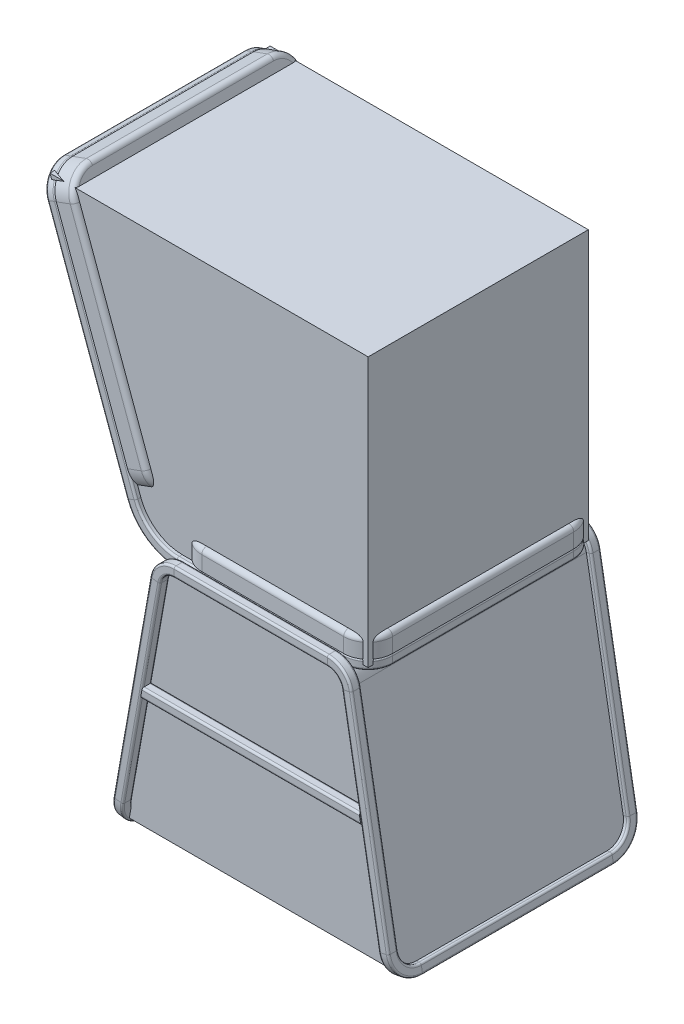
SolidWorks part; units mm, degrees
ref_plane "Front Plane" through (0, 0, 0) normal (0, 0, 1) x (1, 0, 0)
ref_plane "Top Plane" through (0, 0, 0) normal (0, 1, 0) x (1, 0, 0)
ref_plane "Right Plane" through (0, 0, 0) normal (1, 0, 0) x (0, 0, -1)
sketch "Sketch1" plane through (0, 0, 0) normal (0, 0, 1) x (1, 0, 0)
  line L0 (0, 0) -> (-450, 0)
  line L1 (-450, 0) -> (-650.1836, 550)
  line L2 (-650.1836, 550) -> (0, 550)
  line L3 (0, 550) -> (0, 0)
  dimension "D1" = 450
  dimension "D2" = 550
  dimension "D3" = 110
extrude "Boss-Extrude1" add sketch "Sketch1" along normal mid plane 450
sketch3d "3DSketch1"
  line L0 (-636.5028, 512.4123, -225) -> (-636.5028, 512.4123, 225)
  line L1 (-473.9485, 65.798, -225) -> (-473.9485, 65.798, 225)
  line L2 (-379.9792, 0, -225) -> (-379.9792, 0, 225)
  line L4 (-650.1836, 550, -225) -> (-450, 0, -225)
  line L5 (-450, 0, -225) -> (-450, 0, 225)
  line L6 (-450, 0, 225) -> (-650.1836, 550, 225)
  line L7 (-650.1836, 550, 225) -> (-650.1836, 550, -225)
  line L8 (-636.5028, 512.4123, -225) -> (-473.9485, 65.798, -225)
  line L10 (-473.9485, 65.798, 225) -> (-636.5028, 512.4123, 225)
  line L11 (-650.1836, 550, 185) -> (-650.1836, 550, -185)
  line L12 (-450, 0, -225) -> (0, 0, -225)
  line L13 (0, 0, -225) -> (0, 0, 225)
  line L14 (0, 0, 225) -> (-450, 0, 225)
  line L15 (-450, 0, 225) -> (-450, 0, -225)
  line L16 (-379.9792, 0, -225) -> (-40, 0, -225)
  line L17 (0, 0, -185) -> (0, 0, 185)
  line L18 (-40, 0, 225) -> (-379.9792, 0, 225)
  arc A0 (-40, 0, -225) -> (0, 0, -185) centre (-40, 0, -185) ccw
  arc A1 (0, 0, 185) -> (-40, 0, 225) centre (-40, 0, 185) ccw
  arc A2 (-636.5028, 512.4123, -225) -> (-650.1836, 550, -185) centre (-636.5028, 512.4123, -185) ccw
  arc A3 (-636.5028, 512.4123, 225) -> (-650.1836, 550, 185) centre (-636.5028, 512.4123, 185) ccw
  arc A4 (-473.9485, 65.798, -225) -> (-379.9792, 0, -225) centre (-379.9792, 100, -225) ccw
  arc A5 (-379.9792, 0, 225) -> (-473.9485, 65.798, 225) centre (-379.9792, 100, 225) ccw
  point P8 (0, 0, -225)
  point P10 (-40, -40, -185)
  point P13 (0, 0, 225)
  point P15 (-40, -40, 185)
  point P18 (-650.1836, 550, -225)
  point P20 (-598.9151, 526.0931, -185)
  point P23 (-650.1836, 550, 225)
  point P25 (-674.0905, 498.7315, 185)
  point P28 (-450, 0, -225)
  point P30 (-379.9792, 100, -125)
  point P33 (-450, 0, 225)
  point P35 (-379.9792, 100, 125)
  dimension "D3" = 40
  dimension "D4" = 100
  dimension "D1" = 0
  dimension "D2" = 0
other "Square tube - configured 20 X 20 X 2(1)"
ref_plane "Plane1" through (-379.9792, 0, -225) normal (1, 0, 0) x (0, 0, -1)
sketch "Sketch11" plane through (-379.9792, 0, -225) normal (1, 0, 0) x (0, 0, -1)
  line L0 (-6, -8) -> (6, -8)
  line L1 (-8, -6) -> (-8, 6)
  line L2 (6, 8) -> (-6, 8)
  line L3 (8, 6) -> (8, -6)
  line L4 (-6, -10) -> (6, -10)
  line L5 (-10, -6) -> (-10, 6)
  line L6 (6, 10) -> (-6, 10)
  line L7 (10, 6) -> (10, -6)
  arc A0 (10, 6) -> (6, 10) centre (6, 6) ccw
  arc A1 (6, -10) -> (10, -6) centre (6, -6) ccw
  arc A2 (-10, -6) -> (-6, -10) centre (-6, -6) ccw
  arc A3 (-6, 10) -> (-10, 6) centre (-6, 6) ccw
  arc A4 (-6, 8) -> (-8, 6) centre (-6, 6) ccw
  arc A5 (8, 6) -> (6, 8) centre (6, 6) ccw
  arc A6 (6, -8) -> (8, -6) centre (6, -6) ccw
  arc A7 (-8, -6) -> (-6, -8) centre (-6, -6) ccw
  point P0 (-10, 0)
  point P1 (10, 0)
  point P2 (0, 10)
  point P3 (0, -10)
  point P4 (0, 0)
  point P5 (-10, -10)
  point P6 (10, -10)
  point P7 (10, 10)
  point P8 (-10, 10)
  point P33 (0, 0)
  dimension "D1" = 4
  dimension "Thickness" = 2
  dimension "V_leg" = 20
sketch "Sketch12" plane through (0, 0, 235) normal (0, 0, 1) x (1, 0, 0)
  line L0 (-379.9792, 0) -> (-40, 0) construction
  line L1 (-379.9792, -6) -> (-379.9792, 6) construction
  line L2 (-40, 6) -> (-40, -6) construction
  line L3 (-209.9896, 0) -> (-209.9896, -500) construction
  line L4 (-488.1531, -500) -> (68.1739, -500)
  line L5 (68.1739, -500) -> (-14.1613, -33.0541)
  line L6 (-53.5536, 0) -> (-366.4256, 0)
  line L7 (-488.1531, -500) -> (-405.8179, -33.0541)
  arc A0 (-405.8179, -33.0541) -> (-366.4256, 0) centre (-366.4256, -40) cw
  arc A1 (-14.1613, -33.0541) -> (-53.5536, 0) centre (-53.5536, -40) ccw
  point P14 (-399.9896, 0)
  point P17 (-19.9896, 0)
  dimension "D4" = 40
  dimension "D1" = 380
  dimension "D2" = 500
  dimension "D3" = 10
extrude "Boss-Extrude2" add sketch "Sketch12" against normal up to surface (470 mm away) separate body
sketch3d "3DSketch2"
  line L0 (68.1739, -500, -235) -> (68.1739, -500, 235) construction
  line L1 (68.1739, -500, -195) -> (68.1739, -500, 195)
  line L2 (-488.1531, -500, -235) -> (-488.1531, -500, 235) construction
  line L3 (-488.1531, -500, -195) -> (-488.1531, -500, 195)
  line L4 (68.1739, -500, 235) -> (-14.1613, -33.0541, 235)
  line L5 (-53.5536, 0, 235) -> (-366.4256, 0, 235)
  line L6 (-405.8179, -33.0541, 235) -> (-488.1531, -500, 235)
  line L7 (-488.1531, -500, 235) -> (68.1739, -500, 235)
  line L8 (61.2279, -460.6077, 235) -> (-14.1613, -33.0541, 235)
  line L9 (-53.5536, 0, 235) -> (-366.4256, 0, 235)
  line L10 (-405.8179, -33.0541, 235) -> (-481.2072, -460.6077, 235)
  line L12 (-14.1613, -33.0541, -235) -> (68.1739, -500, -235)
  line L13 (68.1739, -500, -235) -> (-488.1531, -500, -235)
  line L14 (-488.1531, -500, -235) -> (-405.8179, -33.0541, -235)
  line L15 (-366.4256, 0, -235) -> (-53.5536, 0, -235)
  line L16 (-14.1613, -33.0541, -235) -> (61.2279, -460.6077, -235)
  line L18 (-481.2072, -460.6077, -235) -> (-405.8179, -33.0541, -235)
  line L19 (-366.4256, 0, -235) -> (-53.5536, 0, -235)
  line L20 (-443.5126, -246.8309, 235) -> (23.5333, -246.8309, 235)
  line L21 (-443.5126, -246.8309, -235) -> (23.5333, -246.8309, -235)
  arc A0 (-481.2072, -460.6077, 235) -> (-488.1531, -500, 195) centre (-481.2072, -460.6077, 195) ccw
  arc A1 (-488.1531, -500, -195) -> (-481.2072, -460.6077, -235) centre (-481.2072, -460.6077, -195) ccw
  arc A2 (-14.1613, -33.0541, 235) -> (-53.5536, 0, 235) centre (-53.5536, -40, 235) ccw
  arc A3 (-366.4256, 0, 235) -> (-405.8179, -33.0541, 235) centre (-366.4256, -40, 235) ccw
  arc A4 (-14.1613, -33.0541, 235) -> (-53.5536, 0, 235) centre (-53.5536, -40, 235) ccw
  arc A5 (-366.4256, 0, 235) -> (-405.8179, -33.0541, 235) centre (-366.4256, -40, 235) ccw
  arc A6 (-405.8179, -33.0541, -235) -> (-366.4256, 0, -235) centre (-366.4256, -40, -235) ccw
  arc A7 (-53.5536, 0, -235) -> (-14.1613, -33.0541, -235) centre (-53.5536, -40, -235) ccw
  arc A8 (-405.8179, -33.0541, -235) -> (-366.4256, 0, -235) centre (-366.4256, -40, -235) ccw
  arc A9 (-53.5536, 0, -235) -> (-14.1613, -33.0541, -235) centre (-53.5536, -40, -235) ccw
  arc A10 (61.2279, -460.6077, -235) -> (68.1739, -500, -195) centre (61.2279, -460.6077, -195) ccw
  arc A11 (61.2279, -460.6077, 235) -> (68.1739, -500, 195) centre (61.2279, -460.6077, 195) ccw
  point P6 (-53.5536, -40, 275)
  point P12 (-366.4256, -40, 275)
  point P14 (-53.5536, -40, 275)
  point P15 (-366.4256, -40, 275)
  point P16 (-366.4256, -40, -275)
  point P22 (-53.5536, -40, -275)
  point P24 (-488.1531, -500, 235)
  point P25 (-366.4256, -40, -275)
  point P26 (-53.5536, -40, -275)
  point P28 (-441.8149, -467.5536, 195)
  point P31 (-488.1531, -500, -235)
  point P33 (-441.8149, -467.5536, -195)
  point P36 (68.1739, -500, -235)
  point P38 (21.8356, -467.5536, -195)
  point P41 (68.1739, -500, 235)
  point P43 (100.6203, -453.6618, 195)
  dimension "D3" = 40
  dimension "D1" = 0
  dimension "D2" = 0
other "Square tube - configured 20 X 20 X 2(2)"
ref_plane "Plane2" through (-53.5536, 0, 245) normal (-1, 0, 0) x (0, 0, 1)
sketch "Sketch13" plane through (-53.5536, 0, 245) normal (-1, 0, 0) x (0, 0, 1)
  line L0 (-6, -8) -> (6, -8)
  line L1 (-8, -6) -> (-8, 6)
  line L2 (6, 8) -> (-6, 8)
  line L3 (8, 6) -> (8, -6)
  line L4 (-6, -10) -> (6, -10)
  line L5 (-10, -6) -> (-10, 6)
  line L6 (6, 10) -> (-6, 10)
  line L7 (10, 6) -> (10, -6)
  arc A0 (10, 6) -> (6, 10) centre (6, 6) ccw
  arc A1 (6, -10) -> (10, -6) centre (6, -6) ccw
  arc A2 (-10, -6) -> (-6, -10) centre (-6, -6) ccw
  arc A3 (-6, 10) -> (-10, 6) centre (-6, 6) ccw
  arc A4 (-6, 8) -> (-8, 6) centre (-6, 6) ccw
  arc A5 (8, 6) -> (6, 8) centre (6, 6) ccw
  arc A6 (6, -8) -> (8, -6) centre (6, -6) ccw
  arc A7 (-8, -6) -> (-6, -8) centre (-6, -6) ccw
  point P0 (-10, 0)
  point P1 (10, 0)
  point P2 (0, 10)
  point P3 (0, -10)
  point P4 (0, 0)
  point P5 (-10, -10)
  point P6 (10, -10)
  point P7 (10, 10)
  point P8 (-10, 10)
  point P33 (0, 0)
  dimension "D1" = 4
  dimension "Thickness" = 2
  dimension "V_leg" = 20
sketch "Sketch14" plane through (0, 10, 0) normal (0, 1, 0) x (1, 0, 0)
  line L0 (-379.9792, -235) -> (-40, -235) construction
  line L1 (10, -185) -> (10, 185) construction
  line L2 (-40, 235) -> (-379.9792, 235) construction
  line L3 (-329.9792, -235) -> (-40, -235)
  line L4 (10, -185) -> (10, 185)
  line L5 (-40, 235) -> (-329.9792, 235)
  line L6 (-379.9792, -185) -> (-379.9792, 185)
  arc A0 (-40, -235) -> (10, -185) centre (-40, -185) ccw construction
  arc A1 (10, 185) -> (-40, 235) centre (-40, 185) ccw construction
  arc A2 (-40, -235) -> (10, -185) centre (-40, -185) ccw
  arc A3 (10, 185) -> (-40, 235) centre (-40, 185) ccw
  arc A4 (-329.9792, -235) -> (-379.9792, -185) centre (-329.9792, -185) cw
  arc A5 (-329.9792, 235) -> (-379.9792, 185) centre (-329.9792, 185) ccw
  dimension "D1" = 50
extrude "Boss-Extrude3" add sketch "Sketch14" along normal blind 40 separate body
fillet "Fillet1" radius 10 8 edges at (-184.9896, 50, 235) (-365.3346, 50, 220.3553) (-379.9792, 50, 0) (-365.3346, 50, -220.3553) (-184.9896, 50, -235) (-4.6447, 50, -220.3553) (10, 50, 0) (-4.6447, 50, 220.3553)
sketch "Sketch15" plane through (-387.9631, -141.207, 0) normal (0.9397, 0.342, 0) x (0, 0, -1)
  line L0 (-235, 699.2068) -> (-235, 223.9298) construction
  line L1 (185, 749.2068) -> (-185, 749.2068) construction
  line L2 (235, 223.9298) -> (235, 699.2068) construction
  line L3 (-235, 699.2068) -> (-235, 273.9298)
  line L4 (185, 749.2068) -> (-185, 749.2068)
  line L5 (235, 273.9298) -> (235, 699.2068)
  line L6 (-185, 223.9298) -> (185, 223.9298)
  arc A0 (-185, 749.2068) -> (-235, 699.2068) centre (-185, 699.2068) ccw construction
  arc A1 (235, 699.2068) -> (185, 749.2068) centre (185, 699.2068) ccw construction
  arc A2 (-185, 749.2068) -> (-235, 699.2068) centre (-185, 699.2068) ccw
  arc A3 (235, 699.2068) -> (185, 749.2068) centre (185, 699.2068) ccw
  arc A4 (-235, 273.9298) -> (-185, 223.9298) centre (-185, 273.9298) ccw
  arc A5 (235, 273.9298) -> (185, 223.9298) centre (185, 273.9298) cw
  dimension "D1" = 50
extrude "Boss-Extrude4" add sketch "Sketch15" along normal blind 40 separate body
fillet "Fillet2" radius 10 8 edges at (-606.6192, 576.4979, 0) (-601.6104, 562.7365, -220.3553) (-516.7915, 329.6985, -235) (-431.9726, 96.6605, -220.3553) (-426.9639, 82.899, 0) (-431.9726, 96.6605, 220.3553) (-516.7915, 329.6985, 235) (-601.6104, 562.7365, 220.3553)
